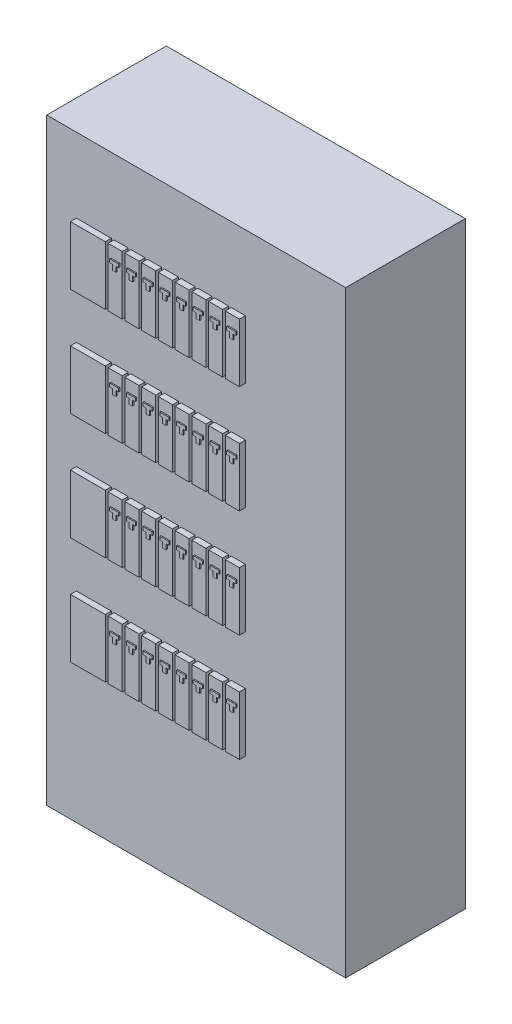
SolidWorks part; units mm, degrees
ref_plane "Plan de face" through (0, 0, 0) normal (0, 0, 1) x (1, 0, 0)
ref_plane "Plan de dessus" through (0, 0, 0) normal (0, 1, 0) x (1, 0, 0)
ref_plane "Plan de droite" through (0, 0, 0) normal (1, 0, 0) x (0, 0, -1)
sketch "Esquisse1" plane through (0, 0, 0) normal (0, 0, 1) x (1, 0, 0)
  line L1 (0, 0) -> (250, 0)
  line L2 (0, 0) -> (0, 500)
  line L3 (0, 500) -> (250, 500)
  line L4 (250, 0) -> (250, 500)
  dimension "D1" = 250
  dimension "D2" = 500
extrude "Boss.-Extru.1" add sketch "Esquisse1" along normal blind 100
sketch "Esquisse2" plane through (0, 0, 100) normal (0, 0, 1) x (1, 0, 0)
  line L0 (70.3453, 388.7615) -> (82.1228, 388.7615)
  line L1 (24.7995, 437.7493) -> (53.9968, 437.7493)
  line L2 (24.7995, 437.7493) -> (24.7995, 388.7615)
  line L3 (24.7995, 388.7615) -> (53.9968, 388.7615)
  line L4 (53.9968, 437.7493) -> (53.9968, 388.7615)
  line L5 (56.3453, 388.7615) -> (68.1228, 388.7615)
  line L6 (56.3453, 388.7615) -> (56.3453, 437.7493)
  line L7 (56.3453, 437.7493) -> (68.1228, 437.7493)
  line L8 (68.1228, 388.7615) -> (68.1228, 437.7493)
  line L9 (70.3453, 388.7615) -> (70.3453, 437.7493)
  line L10 (70.3453, 437.7493) -> (82.1228, 437.7493)
  line L11 (82.1228, 388.7615) -> (82.1228, 437.7493)
  line L12 (84.3453, 388.7615) -> (96.1228, 388.7615)
  line L13 (84.3453, 388.7615) -> (84.3453, 437.7493)
  line L14 (84.3453, 437.7493) -> (96.1228, 437.7493)
  line L15 (96.1228, 388.7615) -> (96.1228, 437.7493)
  line L16 (98.3453, 388.7615) -> (110.1228, 388.7615)
  line L17 (98.3453, 388.7615) -> (98.3453, 437.7493)
  line L18 (98.3453, 437.7493) -> (110.1228, 437.7493)
  line L19 (110.1228, 388.7615) -> (110.1228, 437.7493)
  line L20 (112.3453, 388.7615) -> (124.1228, 388.7615)
  line L21 (112.3453, 388.7615) -> (112.3453, 437.7493)
  line L22 (112.3453, 437.7493) -> (124.1228, 437.7493)
  line L23 (124.1228, 388.7615) -> (124.1228, 437.7493)
  line L24 (126.3453, 388.7615) -> (138.1228, 388.7615)
  line L25 (126.3453, 388.7615) -> (126.3453, 437.7493)
  line L26 (126.3453, 437.7493) -> (138.1228, 437.7493)
  line L27 (138.1228, 388.7615) -> (138.1228, 437.7493)
  line L28 (140.3453, 388.7615) -> (152.1228, 388.7615)
  line L29 (140.3453, 388.7615) -> (140.3453, 437.7493)
  line L30 (140.3453, 437.7493) -> (152.1228, 437.7493)
  line L31 (152.1228, 388.7615) -> (152.1228, 437.7493)
  line L32 (154.3453, 388.7615) -> (166.1228, 388.7615)
  line L33 (154.3453, 388.7615) -> (154.3453, 437.7493)
  line L34 (154.3453, 437.7493) -> (166.1228, 437.7493)
  line L35 (166.1228, 388.7615) -> (166.1228, 437.7493)
  line L36 (70.3453, 298.7615) -> (82.1228, 298.7615)
  line L37 (24.7995, 347.7493) -> (53.9968, 347.7493)
  line L38 (24.7995, 347.7493) -> (24.7995, 298.7615)
  line L39 (24.7995, 298.7615) -> (53.9968, 298.7615)
  line L40 (53.9968, 347.7493) -> (53.9968, 298.7615)
  line L41 (56.3453, 298.7615) -> (68.1228, 298.7615)
  line L42 (56.3453, 298.7615) -> (56.3453, 347.7493)
  line L43 (56.3453, 347.7493) -> (68.1228, 347.7493)
  line L44 (68.1228, 298.7615) -> (68.1228, 347.7493)
  line L45 (70.3453, 298.7615) -> (70.3453, 347.7493)
  line L46 (70.3453, 347.7493) -> (82.1228, 347.7493)
  line L47 (82.1228, 298.7615) -> (82.1228, 347.7493)
  line L48 (84.3453, 298.7615) -> (96.1228, 298.7615)
  line L49 (84.3453, 298.7615) -> (84.3453, 347.7493)
  line L50 (84.3453, 347.7493) -> (96.1228, 347.7493)
  line L51 (96.1228, 298.7615) -> (96.1228, 347.7493)
  line L52 (98.3453, 298.7615) -> (110.1228, 298.7615)
  line L53 (98.3453, 298.7615) -> (98.3453, 347.7493)
  line L54 (98.3453, 347.7493) -> (110.1228, 347.7493)
  line L55 (110.1228, 298.7615) -> (110.1228, 347.7493)
  line L56 (112.3453, 298.7615) -> (124.1228, 298.7615)
  line L57 (112.3453, 298.7615) -> (112.3453, 347.7493)
  line L58 (112.3453, 347.7493) -> (124.1228, 347.7493)
  line L59 (124.1228, 298.7615) -> (124.1228, 347.7493)
  line L60 (126.3453, 298.7615) -> (138.1228, 298.7615)
  line L61 (126.3453, 298.7615) -> (126.3453, 347.7493)
  line L62 (126.3453, 347.7493) -> (138.1228, 347.7493)
  line L63 (138.1228, 298.7615) -> (138.1228, 347.7493)
  line L64 (140.3453, 298.7615) -> (152.1228, 298.7615)
  line L65 (140.3453, 298.7615) -> (140.3453, 347.7493)
  line L66 (140.3453, 347.7493) -> (152.1228, 347.7493)
  line L67 (152.1228, 298.7615) -> (152.1228, 347.7493)
  line L68 (154.3453, 298.7615) -> (166.1228, 298.7615)
  line L69 (154.3453, 298.7615) -> (154.3453, 347.7493)
  line L70 (154.3453, 347.7493) -> (166.1228, 347.7493)
  line L71 (166.1228, 298.7615) -> (166.1228, 347.7493)
  line L72 (70.3453, 208.7615) -> (82.1228, 208.7615)
  line L73 (24.7995, 257.7493) -> (53.9968, 257.7493)
  line L74 (24.7995, 257.7493) -> (24.7995, 208.7615)
  line L75 (24.7995, 208.7615) -> (53.9968, 208.7615)
  line L76 (53.9968, 257.7493) -> (53.9968, 208.7615)
  line L77 (56.3453, 208.7615) -> (68.1228, 208.7615)
  line L78 (56.3453, 208.7615) -> (56.3453, 257.7493)
  line L79 (56.3453, 257.7493) -> (68.1228, 257.7493)
  line L80 (68.1228, 208.7615) -> (68.1228, 257.7493)
  line L81 (70.3453, 208.7615) -> (70.3453, 257.7493)
  line L82 (70.3453, 257.7493) -> (82.1228, 257.7493)
  line L83 (82.1228, 208.7615) -> (82.1228, 257.7493)
  line L84 (84.3453, 208.7615) -> (96.1228, 208.7615)
  line L85 (84.3453, 208.7615) -> (84.3453, 257.7493)
  line L86 (84.3453, 257.7493) -> (96.1228, 257.7493)
  line L87 (96.1228, 208.7615) -> (96.1228, 257.7493)
  line L88 (98.3453, 208.7615) -> (110.1228, 208.7615)
  line L89 (98.3453, 208.7615) -> (98.3453, 257.7493)
  line L90 (98.3453, 257.7493) -> (110.1228, 257.7493)
  line L91 (110.1228, 208.7615) -> (110.1228, 257.7493)
  line L92 (112.3453, 208.7615) -> (124.1228, 208.7615)
  line L93 (112.3453, 208.7615) -> (112.3453, 257.7493)
  line L94 (112.3453, 257.7493) -> (124.1228, 257.7493)
  line L95 (124.1228, 208.7615) -> (124.1228, 257.7493)
  line L96 (126.3453, 208.7615) -> (138.1228, 208.7615)
  line L97 (126.3453, 208.7615) -> (126.3453, 257.7493)
  line L98 (126.3453, 257.7493) -> (138.1228, 257.7493)
  line L99 (138.1228, 208.7615) -> (138.1228, 257.7493)
  line L100 (140.3453, 208.7615) -> (152.1228, 208.7615)
  line L101 (140.3453, 208.7615) -> (140.3453, 257.7493)
  line L102 (140.3453, 257.7493) -> (152.1228, 257.7493)
  line L103 (152.1228, 208.7615) -> (152.1228, 257.7493)
  line L104 (154.3453, 208.7615) -> (166.1228, 208.7615)
  line L105 (154.3453, 208.7615) -> (154.3453, 257.7493)
  line L106 (154.3453, 257.7493) -> (166.1228, 257.7493)
  line L107 (166.1228, 208.7615) -> (166.1228, 257.7493)
  line L108 (70.3453, 118.7615) -> (82.1228, 118.7615)
  line L109 (24.7995, 167.7493) -> (53.9968, 167.7493)
  line L110 (24.7995, 167.7493) -> (24.7995, 118.7615)
  line L111 (24.7995, 118.7615) -> (53.9968, 118.7615)
  line L112 (53.9968, 167.7493) -> (53.9968, 118.7615)
  line L113 (56.3453, 118.7615) -> (68.1228, 118.7615)
  line L114 (56.3453, 118.7615) -> (56.3453, 167.7493)
  line L115 (56.3453, 167.7493) -> (68.1228, 167.7493)
  line L116 (68.1228, 118.7615) -> (68.1228, 167.7493)
  line L117 (70.3453, 118.7615) -> (70.3453, 167.7493)
  line L118 (70.3453, 167.7493) -> (82.1228, 167.7493)
  line L119 (82.1228, 118.7615) -> (82.1228, 167.7493)
  line L120 (84.3453, 118.7615) -> (96.1228, 118.7615)
  line L121 (84.3453, 118.7615) -> (84.3453, 167.7493)
  line L122 (84.3453, 167.7493) -> (96.1228, 167.7493)
  line L123 (96.1228, 118.7615) -> (96.1228, 167.7493)
  line L124 (98.3453, 118.7615) -> (110.1228, 118.7615)
  line L125 (98.3453, 118.7615) -> (98.3453, 167.7493)
  line L126 (98.3453, 167.7493) -> (110.1228, 167.7493)
  line L127 (110.1228, 118.7615) -> (110.1228, 167.7493)
  line L128 (112.3453, 118.7615) -> (124.1228, 118.7615)
  line L129 (112.3453, 118.7615) -> (112.3453, 167.7493)
  line L130 (112.3453, 167.7493) -> (124.1228, 167.7493)
  line L131 (124.1228, 118.7615) -> (124.1228, 167.7493)
  line L132 (126.3453, 118.7615) -> (138.1228, 118.7615)
  line L133 (126.3453, 118.7615) -> (126.3453, 167.7493)
  line L134 (126.3453, 167.7493) -> (138.1228, 167.7493)
  line L135 (138.1228, 118.7615) -> (138.1228, 167.7493)
  line L136 (140.3453, 118.7615) -> (152.1228, 118.7615)
  line L137 (140.3453, 118.7615) -> (140.3453, 167.7493)
  line L138 (140.3453, 167.7493) -> (152.1228, 167.7493)
  line L139 (152.1228, 118.7615) -> (152.1228, 167.7493)
  line L140 (154.3453, 118.7615) -> (166.1228, 118.7615)
  line L141 (154.3453, 118.7615) -> (154.3453, 167.7493)
  line L142 (154.3453, 167.7493) -> (166.1228, 167.7493)
  line L143 (166.1228, 118.7615) -> (166.1228, 167.7493)
  dimension "D1" = 8
  dimension "D2" = 4
extrude "Boss.-Extru.2" add sketch "Esquisse2" along normal blind 5
sketch "Esquisse3" plane through (0, 0, 100) normal (0, 0, 1) x (1, 0, 0)
  line L0 (63.8104, 425.3941) -> (66.0823, 425.3941)
  line L1 (58.5092, 428.2069) -> (66.0823, 428.2069)
  line L2 (58.5092, 428.2069) -> (58.5092, 425.3941)
  line L3 (58.5092, 425.3941) -> (60.9975, 425.3941)
  line L4 (66.0823, 428.2069) -> (66.0823, 425.3941)
  line L5 (77.8104, 425.3941) -> (80.0823, 425.3941)
  line L6 (60.9975, 425.3941) -> (60.9975, 420.9585)
  line L7 (60.9975, 420.9585) -> (63.8104, 420.9585)
  line L8 (63.8104, 425.3941) -> (63.8104, 420.9585)
  line L9 (72.5092, 428.2069) -> (80.0823, 428.2069)
  line L10 (72.5092, 428.2069) -> (72.5092, 425.3941)
  line L11 (72.5092, 425.3941) -> (74.9975, 425.3941)
  line L12 (80.0823, 428.2069) -> (80.0823, 425.3941)
  line L13 (74.9975, 425.3941) -> (74.9975, 420.9585)
  line L14 (74.9975, 420.9585) -> (77.8104, 420.9585)
  line L15 (77.8104, 425.3941) -> (77.8104, 420.9585)
  line L16 (91.8104, 425.3941) -> (94.0823, 425.3941)
  line L17 (86.5092, 428.2069) -> (94.0823, 428.2069)
  line L18 (86.5092, 428.2069) -> (86.5092, 425.3941)
  line L19 (86.5092, 425.3941) -> (88.9975, 425.3941)
  line L20 (94.0823, 428.2069) -> (94.0823, 425.3941)
  line L21 (88.9975, 425.3941) -> (88.9975, 420.9585)
  line L22 (88.9975, 420.9585) -> (91.8104, 420.9585)
  line L23 (91.8104, 425.3941) -> (91.8104, 420.9585)
  line L24 (105.8104, 425.3941) -> (108.0823, 425.3941)
  line L25 (100.5092, 428.2069) -> (108.0823, 428.2069)
  line L26 (100.5092, 428.2069) -> (100.5092, 425.3941)
  line L27 (100.5092, 425.3941) -> (102.9975, 425.3941)
  line L28 (108.0823, 428.2069) -> (108.0823, 425.3941)
  line L29 (102.9975, 425.3941) -> (102.9975, 420.9585)
  line L30 (102.9975, 420.9585) -> (105.8104, 420.9585)
  line L31 (105.8104, 425.3941) -> (105.8104, 420.9585)
  line L32 (119.8104, 425.3941) -> (122.0823, 425.3941)
  line L33 (114.5092, 428.2069) -> (122.0823, 428.2069)
  line L34 (114.5092, 428.2069) -> (114.5092, 425.3941)
  line L35 (114.5092, 425.3941) -> (116.9975, 425.3941)
  line L36 (122.0823, 428.2069) -> (122.0823, 425.3941)
  line L37 (116.9975, 425.3941) -> (116.9975, 420.9585)
  line L38 (116.9975, 420.9585) -> (119.8104, 420.9585)
  line L39 (119.8104, 425.3941) -> (119.8104, 420.9585)
  line L40 (133.8104, 425.3941) -> (136.0823, 425.3941)
  line L41 (128.5092, 428.2069) -> (136.0823, 428.2069)
  line L42 (128.5092, 428.2069) -> (128.5092, 425.3941)
  line L43 (128.5092, 425.3941) -> (130.9975, 425.3941)
  line L44 (136.0823, 428.2069) -> (136.0823, 425.3941)
  line L45 (130.9975, 425.3941) -> (130.9975, 420.9585)
  line L46 (130.9975, 420.9585) -> (133.8104, 420.9585)
  line L47 (133.8104, 425.3941) -> (133.8104, 420.9585)
  line L48 (147.8104, 425.3941) -> (150.0823, 425.3941)
  line L49 (142.5092, 428.2069) -> (150.0823, 428.2069)
  line L50 (142.5092, 428.2069) -> (142.5092, 425.3941)
  line L51 (142.5092, 425.3941) -> (144.9975, 425.3941)
  line L52 (150.0823, 428.2069) -> (150.0823, 425.3941)
  line L53 (144.9975, 425.3941) -> (144.9975, 420.9585)
  line L54 (144.9975, 420.9585) -> (147.8104, 420.9585)
  line L55 (147.8104, 425.3941) -> (147.8104, 420.9585)
  line L56 (161.8104, 425.3941) -> (164.0823, 425.3941)
  line L57 (156.5092, 428.2069) -> (164.0823, 428.2069)
  line L58 (156.5092, 428.2069) -> (156.5092, 425.3941)
  line L59 (156.5092, 425.3941) -> (158.9975, 425.3941)
  line L60 (164.0823, 428.2069) -> (164.0823, 425.3941)
  line L61 (158.9975, 425.3941) -> (158.9975, 420.9585)
  line L62 (158.9975, 420.9585) -> (161.8104, 420.9585)
  line L63 (161.8104, 425.3941) -> (161.8104, 420.9585)
  line L64 (77.8104, 335.3941) -> (80.0823, 335.3941)
  line L65 (72.5092, 338.2069) -> (80.0823, 338.2069)
  line L66 (72.5092, 338.2069) -> (72.5092, 335.3941)
  line L67 (72.5092, 335.3941) -> (74.9975, 335.3941)
  line L68 (80.0823, 338.2069) -> (80.0823, 335.3941)
  line L69 (74.9975, 335.3941) -> (74.9975, 330.9585)
  line L70 (74.9975, 330.9585) -> (77.8104, 330.9585)
  line L71 (77.8104, 335.3941) -> (77.8104, 330.9585)
  line L72 (91.8104, 335.3941) -> (94.0823, 335.3941)
  line L73 (86.5092, 338.2069) -> (94.0823, 338.2069)
  line L74 (86.5092, 338.2069) -> (86.5092, 335.3941)
  line L75 (86.5092, 335.3941) -> (88.9975, 335.3941)
  line L76 (94.0823, 338.2069) -> (94.0823, 335.3941)
  line L77 (88.9975, 335.3941) -> (88.9975, 330.9585)
  line L78 (88.9975, 330.9585) -> (91.8104, 330.9585)
  line L79 (91.8104, 335.3941) -> (91.8104, 330.9585)
  line L80 (105.8104, 335.3941) -> (108.0823, 335.3941)
  line L81 (100.5092, 338.2069) -> (108.0823, 338.2069)
  line L82 (100.5092, 338.2069) -> (100.5092, 335.3941)
  line L83 (100.5092, 335.3941) -> (102.9975, 335.3941)
  line L84 (108.0823, 338.2069) -> (108.0823, 335.3941)
  line L85 (102.9975, 335.3941) -> (102.9975, 330.9585)
  line L86 (102.9975, 330.9585) -> (105.8104, 330.9585)
  line L87 (105.8104, 335.3941) -> (105.8104, 330.9585)
  line L88 (119.8104, 335.3941) -> (122.0823, 335.3941)
  line L89 (114.5092, 338.2069) -> (122.0823, 338.2069)
  line L90 (114.5092, 338.2069) -> (114.5092, 335.3941)
  line L91 (114.5092, 335.3941) -> (116.9975, 335.3941)
  line L92 (122.0823, 338.2069) -> (122.0823, 335.3941)
  line L93 (116.9975, 335.3941) -> (116.9975, 330.9585)
  line L94 (116.9975, 330.9585) -> (119.8104, 330.9585)
  line L95 (119.8104, 335.3941) -> (119.8104, 330.9585)
  line L96 (133.8104, 335.3941) -> (136.0823, 335.3941)
  line L97 (128.5092, 338.2069) -> (136.0823, 338.2069)
  line L98 (128.5092, 338.2069) -> (128.5092, 335.3941)
  line L99 (128.5092, 335.3941) -> (130.9975, 335.3941)
  line L100 (136.0823, 338.2069) -> (136.0823, 335.3941)
  line L101 (130.9975, 335.3941) -> (130.9975, 330.9585)
  line L102 (130.9975, 330.9585) -> (133.8104, 330.9585)
  line L103 (133.8104, 335.3941) -> (133.8104, 330.9585)
  line L104 (147.8104, 335.3941) -> (150.0823, 335.3941)
  line L105 (142.5092, 338.2069) -> (150.0823, 338.2069)
  line L106 (142.5092, 338.2069) -> (142.5092, 335.3941)
  line L107 (142.5092, 335.3941) -> (144.9975, 335.3941)
  line L108 (150.0823, 338.2069) -> (150.0823, 335.3941)
  line L109 (144.9975, 335.3941) -> (144.9975, 330.9585)
  line L110 (144.9975, 330.9585) -> (147.8104, 330.9585)
  line L111 (147.8104, 335.3941) -> (147.8104, 330.9585)
  line L112 (161.8104, 335.3941) -> (164.0823, 335.3941)
  line L113 (156.5092, 338.2069) -> (164.0823, 338.2069)
  line L114 (156.5092, 338.2069) -> (156.5092, 335.3941)
  line L115 (156.5092, 335.3941) -> (158.9975, 335.3941)
  line L116 (164.0823, 338.2069) -> (164.0823, 335.3941)
  line L117 (158.9975, 335.3941) -> (158.9975, 330.9585)
  line L118 (158.9975, 330.9585) -> (161.8104, 330.9585)
  line L119 (161.8104, 335.3941) -> (161.8104, 330.9585)
  line L120 (77.8104, 245.3941) -> (80.0823, 245.3941)
  line L121 (72.5092, 248.2069) -> (80.0823, 248.2069)
  line L122 (72.5092, 248.2069) -> (72.5092, 245.3941)
  line L123 (72.5092, 245.3941) -> (74.9975, 245.3941)
  line L124 (80.0823, 248.2069) -> (80.0823, 245.3941)
  line L125 (74.9975, 245.3941) -> (74.9975, 240.9585)
  line L126 (74.9975, 240.9585) -> (77.8104, 240.9585)
  line L127 (77.8104, 245.3941) -> (77.8104, 240.9585)
  line L128 (91.8104, 245.3941) -> (94.0823, 245.3941)
  line L129 (86.5092, 248.2069) -> (94.0823, 248.2069)
  line L130 (86.5092, 248.2069) -> (86.5092, 245.3941)
  line L131 (86.5092, 245.3941) -> (88.9975, 245.3941)
  line L132 (94.0823, 248.2069) -> (94.0823, 245.3941)
  line L133 (88.9975, 245.3941) -> (88.9975, 240.9585)
  line L134 (88.9975, 240.9585) -> (91.8104, 240.9585)
  line L135 (91.8104, 245.3941) -> (91.8104, 240.9585)
  line L136 (105.8104, 245.3941) -> (108.0823, 245.3941)
  line L137 (100.5092, 248.2069) -> (108.0823, 248.2069)
  line L138 (100.5092, 248.2069) -> (100.5092, 245.3941)
  line L139 (100.5092, 245.3941) -> (102.9975, 245.3941)
  line L140 (108.0823, 248.2069) -> (108.0823, 245.3941)
  line L141 (102.9975, 245.3941) -> (102.9975, 240.9585)
  line L142 (102.9975, 240.9585) -> (105.8104, 240.9585)
  line L143 (105.8104, 245.3941) -> (105.8104, 240.9585)
  line L144 (119.8104, 245.3941) -> (122.0823, 245.3941)
  line L145 (114.5092, 248.2069) -> (122.0823, 248.2069)
  line L146 (114.5092, 248.2069) -> (114.5092, 245.3941)
  line L147 (114.5092, 245.3941) -> (116.9975, 245.3941)
  line L148 (122.0823, 248.2069) -> (122.0823, 245.3941)
  line L149 (116.9975, 245.3941) -> (116.9975, 240.9585)
  line L150 (116.9975, 240.9585) -> (119.8104, 240.9585)
  line L151 (119.8104, 245.3941) -> (119.8104, 240.9585)
  line L152 (133.8104, 245.3941) -> (136.0823, 245.3941)
  line L153 (128.5092, 248.2069) -> (136.0823, 248.2069)
  line L154 (128.5092, 248.2069) -> (128.5092, 245.3941)
  line L155 (128.5092, 245.3941) -> (130.9975, 245.3941)
  line L156 (136.0823, 248.2069) -> (136.0823, 245.3941)
  line L157 (130.9975, 245.3941) -> (130.9975, 240.9585)
  line L158 (130.9975, 240.9585) -> (133.8104, 240.9585)
  line L159 (133.8104, 245.3941) -> (133.8104, 240.9585)
  line L160 (147.8104, 245.3941) -> (150.0823, 245.3941)
  line L161 (142.5092, 248.2069) -> (150.0823, 248.2069)
  line L162 (142.5092, 248.2069) -> (142.5092, 245.3941)
  line L163 (142.5092, 245.3941) -> (144.9975, 245.3941)
  line L164 (150.0823, 248.2069) -> (150.0823, 245.3941)
  line L165 (144.9975, 245.3941) -> (144.9975, 240.9585)
  line L166 (144.9975, 240.9585) -> (147.8104, 240.9585)
  line L167 (147.8104, 245.3941) -> (147.8104, 240.9585)
  line L168 (161.8104, 245.3941) -> (164.0823, 245.3941)
  line L169 (156.5092, 248.2069) -> (164.0823, 248.2069)
  line L170 (156.5092, 248.2069) -> (156.5092, 245.3941)
  line L171 (156.5092, 245.3941) -> (158.9975, 245.3941)
  line L172 (164.0823, 248.2069) -> (164.0823, 245.3941)
  line L173 (158.9975, 245.3941) -> (158.9975, 240.9585)
  line L174 (158.9975, 240.9585) -> (161.8104, 240.9585)
  line L175 (161.8104, 245.3941) -> (161.8104, 240.9585)
  line L176 (77.8104, 155.3941) -> (80.0823, 155.3941)
  line L177 (72.5092, 158.2069) -> (80.0823, 158.2069)
  line L178 (72.5092, 158.2069) -> (72.5092, 155.3941)
  line L179 (72.5092, 155.3941) -> (74.9975, 155.3941)
  line L180 (80.0823, 158.2069) -> (80.0823, 155.3941)
  line L181 (74.9975, 155.3941) -> (74.9975, 150.9585)
  line L182 (74.9975, 150.9585) -> (77.8104, 150.9585)
  line L183 (77.8104, 155.3941) -> (77.8104, 150.9585)
  line L184 (91.8104, 155.3941) -> (94.0823, 155.3941)
  line L185 (86.5092, 158.2069) -> (94.0823, 158.2069)
  line L186 (86.5092, 158.2069) -> (86.5092, 155.3941)
  line L187 (86.5092, 155.3941) -> (88.9975, 155.3941)
  line L188 (94.0823, 158.2069) -> (94.0823, 155.3941)
  line L189 (88.9975, 155.3941) -> (88.9975, 150.9585)
  line L190 (88.9975, 150.9585) -> (91.8104, 150.9585)
  line L191 (91.8104, 155.3941) -> (91.8104, 150.9585)
  line L192 (105.8104, 155.3941) -> (108.0823, 155.3941)
  line L193 (100.5092, 158.2069) -> (108.0823, 158.2069)
  line L194 (100.5092, 158.2069) -> (100.5092, 155.3941)
  line L195 (100.5092, 155.3941) -> (102.9975, 155.3941)
  line L196 (108.0823, 158.2069) -> (108.0823, 155.3941)
  line L197 (102.9975, 155.3941) -> (102.9975, 150.9585)
  line L198 (102.9975, 150.9585) -> (105.8104, 150.9585)
  line L199 (105.8104, 155.3941) -> (105.8104, 150.9585)
  line L200 (119.8104, 155.3941) -> (122.0823, 155.3941)
  line L201 (114.5092, 158.2069) -> (122.0823, 158.2069)
  line L202 (114.5092, 158.2069) -> (114.5092, 155.3941)
  line L203 (114.5092, 155.3941) -> (116.9975, 155.3941)
  line L204 (122.0823, 158.2069) -> (122.0823, 155.3941)
  line L205 (116.9975, 155.3941) -> (116.9975, 150.9585)
  line L206 (116.9975, 150.9585) -> (119.8104, 150.9585)
  line L207 (119.8104, 155.3941) -> (119.8104, 150.9585)
  line L208 (133.8104, 155.3941) -> (136.0823, 155.3941)
  line L209 (128.5092, 158.2069) -> (136.0823, 158.2069)
  line L210 (128.5092, 158.2069) -> (128.5092, 155.3941)
  line L211 (128.5092, 155.3941) -> (130.9975, 155.3941)
  line L212 (136.0823, 158.2069) -> (136.0823, 155.3941)
  line L213 (130.9975, 155.3941) -> (130.9975, 150.9585)
  line L214 (130.9975, 150.9585) -> (133.8104, 150.9585)
  line L215 (133.8104, 155.3941) -> (133.8104, 150.9585)
  line L216 (147.8104, 155.3941) -> (150.0823, 155.3941)
  line L217 (142.5092, 158.2069) -> (150.0823, 158.2069)
  line L218 (142.5092, 158.2069) -> (142.5092, 155.3941)
  line L219 (142.5092, 155.3941) -> (144.9975, 155.3941)
  line L220 (150.0823, 158.2069) -> (150.0823, 155.3941)
  line L221 (144.9975, 155.3941) -> (144.9975, 150.9585)
  line L222 (144.9975, 150.9585) -> (147.8104, 150.9585)
  line L223 (147.8104, 155.3941) -> (147.8104, 150.9585)
  line L224 (161.8104, 155.3941) -> (164.0823, 155.3941)
  line L225 (156.5092, 158.2069) -> (164.0823, 158.2069)
  line L226 (156.5092, 158.2069) -> (156.5092, 155.3941)
  line L227 (156.5092, 155.3941) -> (158.9975, 155.3941)
  line L228 (164.0823, 158.2069) -> (164.0823, 155.3941)
  line L229 (158.9975, 155.3941) -> (158.9975, 150.9585)
  line L230 (158.9975, 150.9585) -> (161.8104, 150.9585)
  line L231 (161.8104, 155.3941) -> (161.8104, 150.9585)
  line L232 (63.8104, 335.3941) -> (66.0823, 335.3941)
  line L233 (58.5092, 338.2069) -> (66.0823, 338.2069)
  line L234 (58.5092, 338.2069) -> (58.5092, 335.3941)
  line L235 (58.5092, 335.3941) -> (60.9975, 335.3941)
  line L236 (66.0823, 338.2069) -> (66.0823, 335.3941)
  line L237 (60.9975, 335.3941) -> (60.9975, 330.9585)
  line L238 (60.9975, 330.9585) -> (63.8104, 330.9585)
  line L239 (63.8104, 335.3941) -> (63.8104, 330.9585)
  line L240 (63.8104, 245.3941) -> (66.0823, 245.3941)
  line L241 (58.5092, 248.2069) -> (66.0823, 248.2069)
  line L242 (58.5092, 248.2069) -> (58.5092, 245.3941)
  line L243 (58.5092, 245.3941) -> (60.9975, 245.3941)
  line L244 (66.0823, 248.2069) -> (66.0823, 245.3941)
  line L245 (60.9975, 245.3941) -> (60.9975, 240.9585)
  line L246 (60.9975, 240.9585) -> (63.8104, 240.9585)
  line L247 (63.8104, 245.3941) -> (63.8104, 240.9585)
  line L248 (63.8104, 155.3941) -> (66.0823, 155.3941)
  line L249 (58.5092, 158.2069) -> (66.0823, 158.2069)
  line L250 (58.5092, 158.2069) -> (58.5092, 155.3941)
  line L251 (58.5092, 155.3941) -> (60.9975, 155.3941)
  line L252 (66.0823, 158.2069) -> (66.0823, 155.3941)
  line L253 (60.9975, 155.3941) -> (60.9975, 150.9585)
  line L254 (60.9975, 150.9585) -> (63.8104, 150.9585)
  line L255 (63.8104, 155.3941) -> (63.8104, 150.9585)
  dimension "D1" = 8
  dimension "D2" = 4
extrude "Boss.-Extru.4" add sketch "Esquisse3" along normal blind 6
